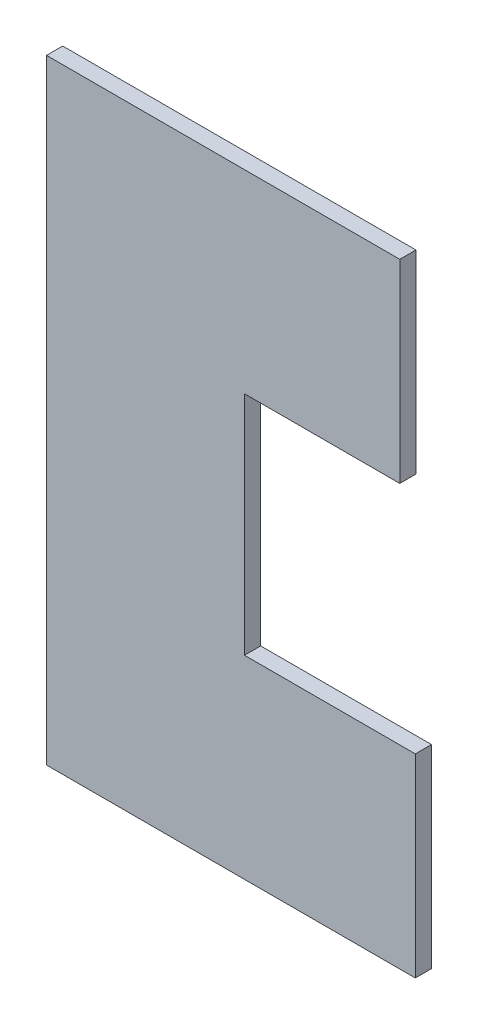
SolidWorks part; units mm, degrees
ref_plane "Спереди" through (0, 0, 0) normal (0, 0, 1) x (1, 0, 0)
ref_plane "Сверху" through (0, 0, 0) normal (0, 1, 0) x (1, 0, 0)
ref_plane "Справа" through (0, 0, 0) normal (1, 0, 0) x (0, 0, -1)
sketch "Эскиз1" plane through (0, 0, 0) normal (0, 0, 1) x (1, 0, 0)
  line L0 (0, 0) -> (285, 0)
  line L1 (285, 0) -> (285, 150)
  line L2 (285, 150) -> (153, 150)
  line L3 (153, 150) -> (153, 325)
  line L4 (153, 325) -> (273, 325)
  line L5 (273, 325) -> (273, 475)
  line L6 (273, 475) -> (0, 475)
  line L7 (0, 475) -> (0, 0)
  dimension "D1" = 273
  dimension "D2" = 285
  dimension "D3" = 132
  dimension "D4" = 475
  dimension "D5" = 150
  dimension "D6" = 150
extrude "Вытянуть1" add sketch "Эскиз1" along normal blind 12.5
